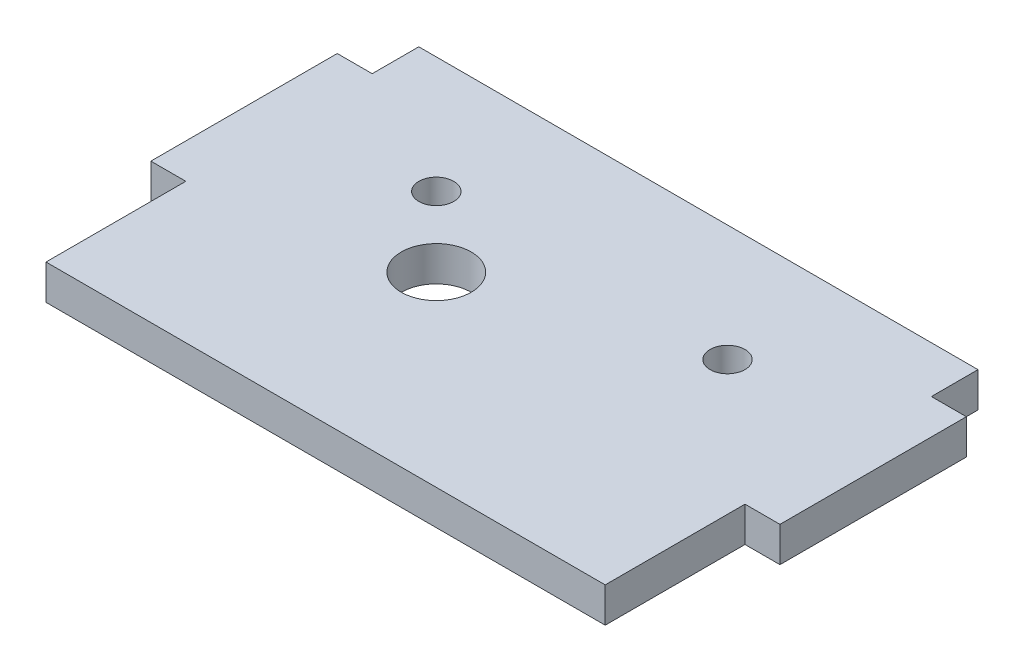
SolidWorks part; units mm, degrees
ref_plane "Front Plane" through (0, 0, 0) normal (0, 0, 1) x (1, 0, 0)
ref_plane "Top Plane" through (0, 0, 0) normal (0, 1, 0) x (1, 0, 0)
ref_plane "Right Plane" through (0, 0, 0) normal (1, 0, 0) x (0, 0, -1)
sketch "Sketch1" plane through (0, 0, 0) normal (0, 1, 0) x (1, 0, 0)
  line L1 (-24, 10) -> (24, 10)
  line L2 (-24, 10) -> (-24, -10)
  line L3 (-24, -10) -> (24, -10)
  line L4 (24, 10) -> (24, -10)
  line L5 (-24, 10) -> (24, -10) construction
  line L6 (-24, -10) -> (24, 10) construction
  point P0 (0, 0)
  dimension "D1" = 48
  dimension "D2" = 20
extrude "Boss-Extrude1" add sketch "Sketch1" along normal blind 3
sketch "Sketch2" plane through (0, 0, 0) normal (0, 1, 0) x (1, 0, 0)
  line L0 (0, 0) -> (0, 3.8379) construction
  line L1 (-24, 0) -> (-25.5, 0) construction
  line L2 (-24, 10) -> (-24, -10) construction
  line L3 (27, -6) -> (24, 6) construction
  line L4 (-27, 6) -> (-24, 6)
  line L5 (-27, 6) -> (-27, -6)
  line L6 (-27, -6) -> (-24, -6)
  line L7 (-24, 6) -> (-24, -6)
  line L8 (-27, 6) -> (-24, -6) construction
  line L9 (-27, -6) -> (-24, 6) construction
  line L10 (27, 6) -> (24, -6) construction
  line L11 (24, 0) -> (25.5, 0) construction
  line L12 (24, 6) -> (24, -6)
  line L13 (27, -6) -> (24, -6)
  line L14 (27, 6) -> (27, -6)
  line L15 (27, 6) -> (24, 6)
  dimension "D1" = 3
  dimension "D2" = 12
extrude "Boss-Extrude2" add sketch "Sketch2" along normal blind 3
sketch "Sketch3" plane through (0, 0, 0) normal (0, 1, 0) x (1, 0, 0)
  line L0 (0, 0) -> (-6.5, 0) construction
  line L1 (-6.5, 0) -> (-6.5, -6) construction
  line L2 (-9.5, -6) -> (-9.5, -10) construction
  line L3 (-24, -10) -> (24, -10) construction
  line L4 (-3.5, -6) -> (-3.5, -10) construction
  line L5 (-3.5, -10) -> (-9.5, -10) construction
  line L6 (0, 0) -> (0, -19.5195) construction
  arc A0 (-3.5, -6) -> (-9.5, -6) centre (-6.5, -6) ccw construction
  circle A1 centre (-6.5, -6) radius 3
  dimension "D2" = 6
  dimension "D4" = 6
  dimension "D1" = 6.5
  dimension "D3" = 6
extrude "Cut-Extrude1" cut sketch "Sketch3" along normal blind 3
sketch "Sketch4" plane through (0, 0, 0) normal (0, 1, 0) x (1, 0, 0)
  line L0 (-12.5, 0) -> (12.5, 0) construction
  circle A0 centre (-12.5, 0) radius 1.5
  circle A1 centre (12.5, 0) radius 1.5
  point P3 (0, 0)
  dimension "D1" = 3
  dimension "D2" = 25
extrude "Cut-Extrude2" cut sketch "Sketch4" along normal blind 3
sketch "Sketch5" plane through (0, 0, 0) normal (0, 1, 0) x (1, 0, 0)
  line L1 (-24, -10) -> (24, -10)
  line L2 (-24, -10) -> (-24, -22)
  line L3 (-24, -22) -> (24, -22)
  line L4 (24, -10) -> (24, -22)
  line L5 (24, 10) -> (-24, 10) construction
  dimension "D1" = 32
extrude "Boss-Extrude3" add sketch "Sketch5" along normal blind 3
sketch "Sketch6" plane through (0, 0, 0) normal (0, 1, 0) x (1, 0, 0)
  line L1 (-27, -6) -> (-24, -6)
  line L2 (-27, -6) -> (-27, -10)
  line L3 (-27, -10) -> (-24, -10)
  line L4 (-24, -6) -> (-24, -10)
  line L5 (-24, -6) -> (-24, -22) construction
  line L6 (0, 0) -> (0, -3.8832) construction
  line L7 (24, -6) -> (24, -10)
  line L8 (27, -10) -> (24, -10)
  line L9 (27, -6) -> (27, -10)
  line L10 (27, -6) -> (24, -6)
  dimension "D1" = 4
extrude "Boss-Extrude4" add sketch "Sketch6" along normal blind 3
